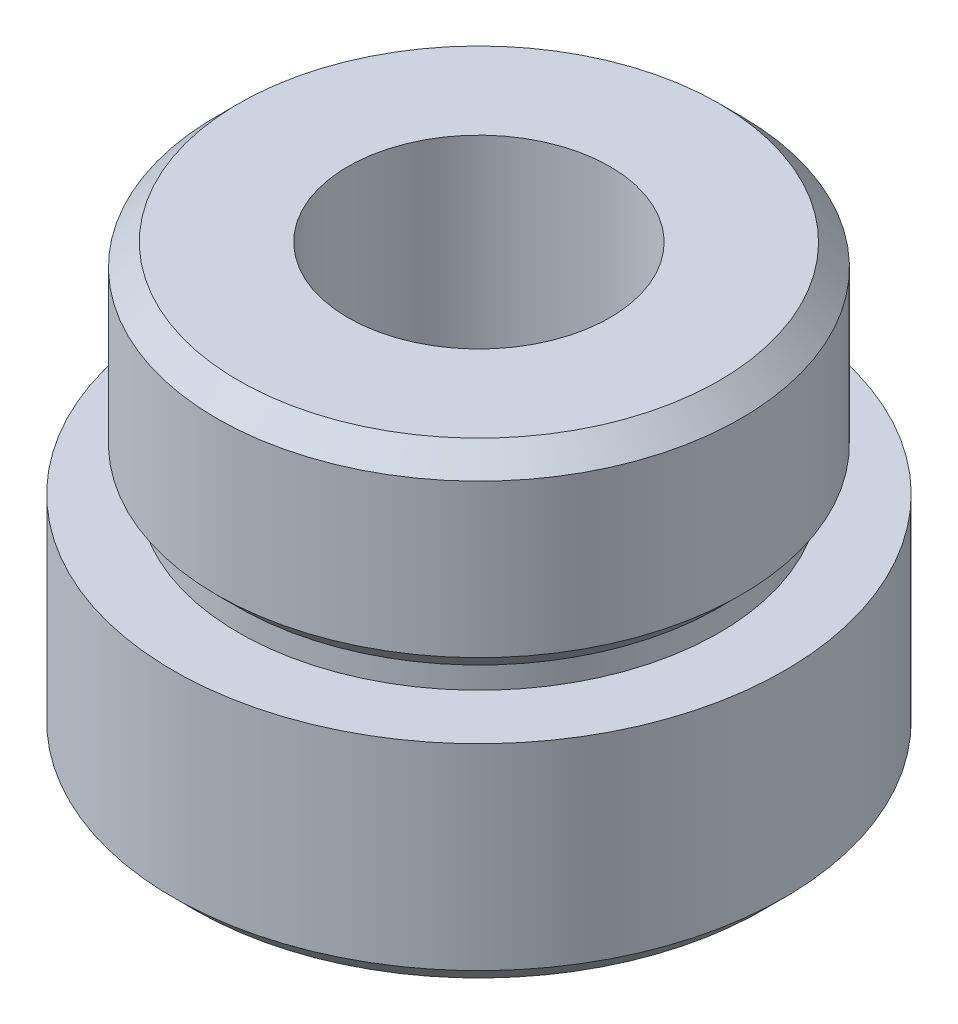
SolidWorks part; units mm, degrees
ref_plane "Plan de face" through (0, 0, 0) normal (0, 0, 1) x (1, 0, 0)
ref_plane "Plan de dessus" through (0, 0, 0) normal (0, 1, 0) x (1, 0, 0)
ref_plane "Plan de droite" through (0, 0, 0) normal (1, 0, 0) x (0, 0, -1)
sketch "Esquisse1" plane through (0, 0, 0) normal (0, 0, 1) x (1, 0, 0)
  line L0 (-3, 1.7886) -> (-6.5, 1.7886)
  line L1 (-6.5, 1.7886) -> (-7, 2.2886)
  line L2 (-7, 2.2886) -> (-7, 6.7886)
  line L3 (-7, 6.7886) -> (-5.5, 6.7886)
  line L4 (-5.5, 6.7886) -> (-5.5, 7.2886)
  line L5 (-5.5, 7.2886) -> (-6, 7.7886)
  line L6 (-6, 7.7886) -> (-6, 11.2886)
  line L7 (-6, 11.2886) -> (-5.5, 11.7886)
  line L8 (-5.5, 11.7886) -> (-3, 11.7886)
  line L9 (0, 0) -> (0, 14) construction
  line L10 (-3, 11.7886) -> (-3, 1.7886)
  dimension "D1" = 6
  dimension "D2" = 7
  dimension "D3" = 4.5
  dimension "D4" = 0.5
  dimension "D5" = 0.5
  dimension "D6" = 0.5
  dimension "D7" = 0.5
  dimension "D8" = 0.5
  dimension "D9" = 5
  dimension "D10" = 0.5
  dimension "D11" = 0.5
revolve "Révolution1" add sketch "Esquisse1" angle 360 about L9
